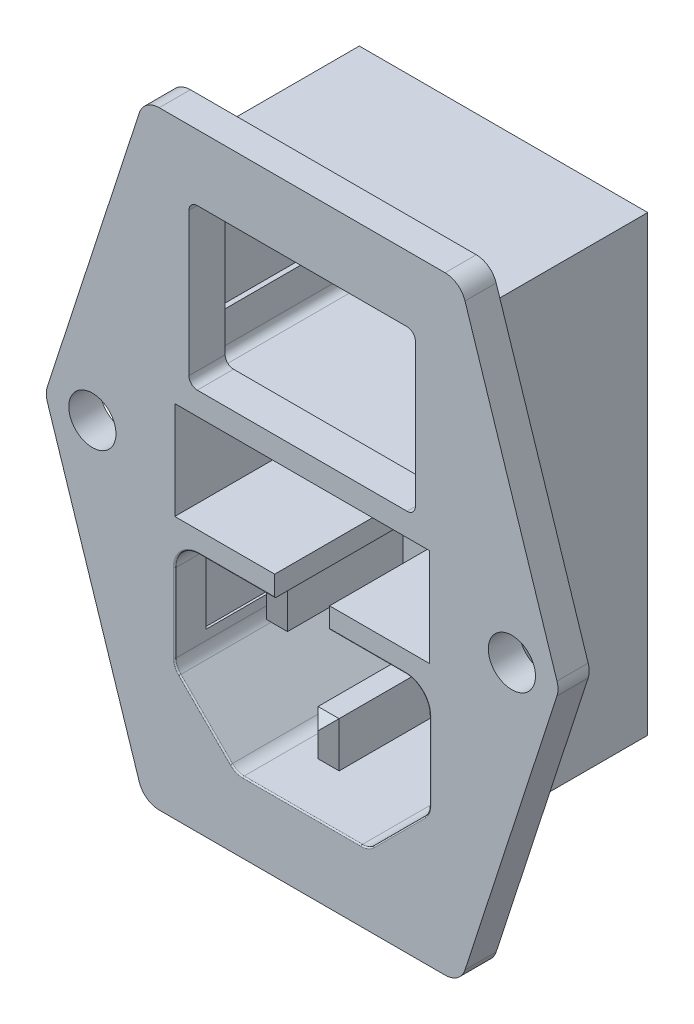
SolidWorks part; units mm, degrees
other "Body16"
other "Body55"
other "Body10"
other "Body15"
other "Body49"
other "Body46"
other "Body50"
other "Body18"
other "Body42"
ref_plane "Płaszczyzna przednia" through (0, 0, 0) normal (0, 0, 1) x (1, 0, 0)
ref_plane "Płaszczyzna górna" through (0, 0, 0) normal (0, 1, 0) x (1, 0, 0)
ref_plane "Płaszczyzna prawa" through (0, 0, 0) normal (1, 0, 0) x (0, 0, -1)
imported_body "Import1"
imported_body "Import2"
imported_body "Import3"
imported_body "Import4"
imported_body "Import5"
imported_body "Import6"
imported_body "Import7"
imported_body "Import8"
imported_body "Import9"
sketch "Szkic2" plane through (0, 0, 0) normal (0, 0, -1) x (-1, 0, 0)
  line L1 (-13.75, 24.4318) -> (13.75, 24.4318)
  line L2 (13.75, 24.4318) -> (13.75, -18.7368)
  line L3 (13.75, -18.7368) -> (8.9186, -23.5682)
  line L4 (8.9186, -23.5682) -> (-8.9186, -23.5682)
  line L5 (-8.9186, -23.5682) -> (-13.75, -18.7368)
  line L6 (8.8367, -22.5894) -> (13.1343, -18.2919)
  line L7 (-8.2755, -22.8219) -> (8.2755, -22.8219)
  line L8 (-13.1343, -18.2919) -> (-8.8367, -22.5894)
  line L9 (-13.3668, 22.8918) -> (-13.3667, -17.7306)
  line L10 (12.573, 23.6855) -> (-12.573, 23.6855)
  line L11 (13.3668, -17.7306) -> (13.3668, 22.8918)
  line L12 (8.8367, -22.5894) -> (13.1343, -18.2919)
  line L13 (-8.2755, -22.8219) -> (8.2755, -22.8219)
  line L14 (-13.1343, -18.2919) -> (-8.8367, -22.5894)
  line L15 (-13.3668, 22.8918) -> (-13.3667, -17.7306)
  line L16 (12.573, 23.6855) -> (-12.573, 23.6855)
  line L17 (13.3668, -17.7306) -> (13.3668, 22.8918)
  line L18 (-13.75, -18.7368) -> (-13.75, 24.4318)
  line L19 (0, 23.6855) -> (0, 24.4318) construction
  line L21 (0, -22.8219) -> (0, -23.5682) construction
  arc A6 (13.1343, -18.2919) -> (13.3668, -17.7306) centre (12.573, -17.7306) ccw
  arc A7 (8.2755, -22.8219) -> (8.8367, -22.5894) centre (8.2755, -22.0282) ccw
  arc A8 (-8.8367, -22.5894) -> (-8.2755, -22.8219) centre (-8.2755, -22.0282) ccw
  arc A9 (-13.3667, -17.7306) -> (-13.1343, -18.2919) centre (-12.573, -17.7306) ccw
  arc A10 (-12.573, 23.6855) -> (-13.3668, 22.8918) centre (-12.573, 22.8917) ccw
  arc A11 (13.3668, 22.8918) -> (12.573, 23.6855) centre (12.573, 22.8917) ccw
  arc A12 (13.1343, -18.2919) -> (13.3668, -17.7306) centre (12.573, -17.7306) ccw
  arc A13 (8.2755, -22.8219) -> (8.8367, -22.5894) centre (8.2755, -22.0282) ccw
  arc A14 (-8.8367, -22.5894) -> (-8.2755, -22.8219) centre (-8.2755, -22.0282) ccw
  arc A15 (-13.3667, -17.7306) -> (-13.1343, -18.2919) centre (-12.573, -17.7306) ccw
  arc A16 (-12.573, 23.6855) -> (-13.3668, 22.8918) centre (-12.573, 22.8917) ccw
  arc A17 (13.3668, 22.8918) -> (12.573, 23.6855) centre (12.573, 22.8917) ccw
  dimension "D2" = 48
  dimension "D3" = 27.5
  dimension "D4" = 0.75
  dimension "D1" = 0
extrude "Dodanie-wyciągnięcie1" add sketch "Szkic2" along normal up to surface (16.2306 mm away)
